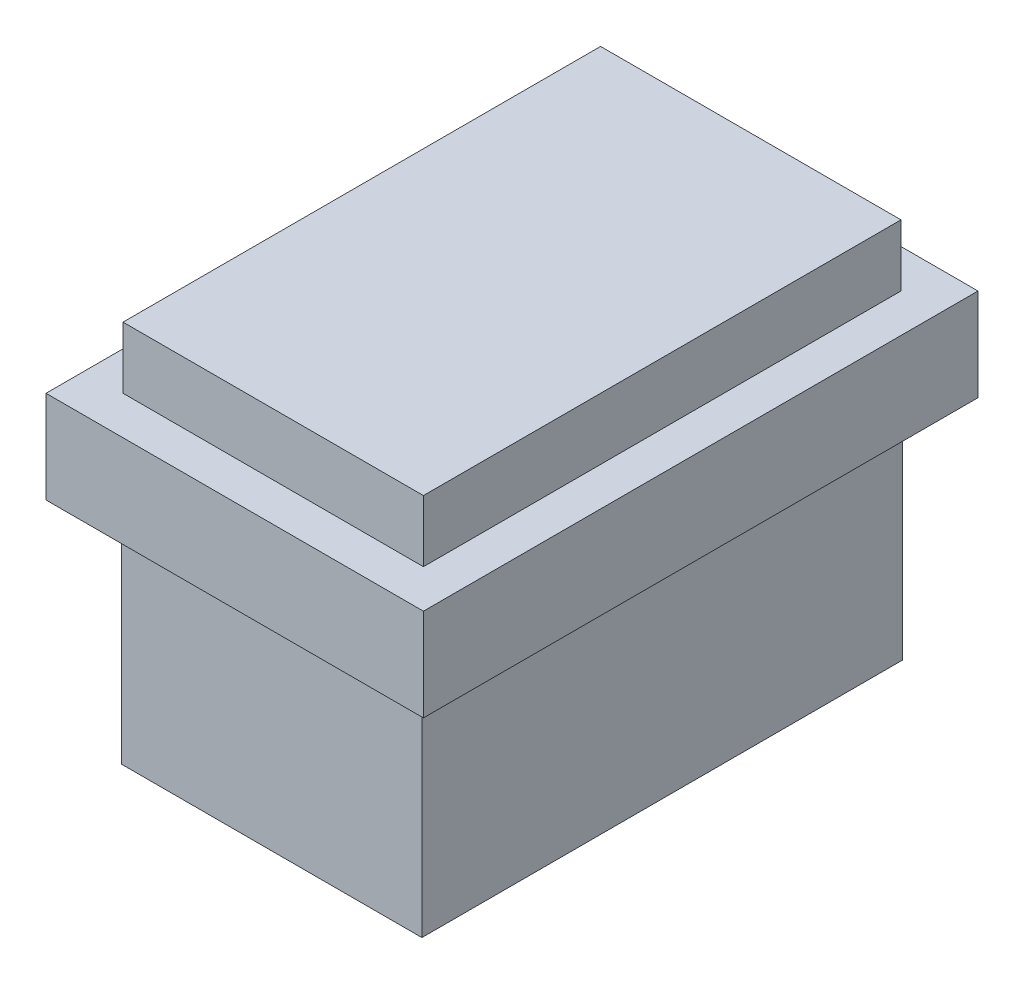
SolidWorks part; units mm, degrees
ref_plane "Front" through (0, 0, 0) normal (0, 0, 1) x (1, 0, 0)
ref_plane "Top" through (0, 0, 0) normal (0, 1, 0) x (1, 0, 0)
ref_plane "Right" through (0, 0, 0) normal (1, 0, 0) x (0, 0, -1)
sketch "Sketch1" plane through (0, 0, 0) normal (1, 0, 0) x (0, 0, -1)
  line L1 (-198.12, 0) -> (198.12, 0)
  line L2 (-198.12, 0) -> (-198.12, 187.96)
  line L3 (-198.12, 187.96) -> (198.12, 187.96)
  line L4 (198.12, 0) -> (198.12, 187.96)
  dimension "D1" = 396.24
  dimension "D2" = 187.96
extrude "Extrude1" add sketch "Sketch1" along normal mid plane 247.65
sketch "Sketch2" plane through (0, 187.96, 0) normal (0, 1, 0) x (-1, 0, 0)
  line L1 (155.575, 228.6) -> (-155.575, 228.6)
  line L2 (155.575, 228.6) -> (155.575, -228.6)
  line L3 (155.575, -228.6) -> (-155.575, -228.6)
  line L4 (-155.575, 228.6) -> (-155.575, -228.6)
  line L6 (0, -228.6) -> (0, 228.6) construction
  line L7 (155.575, 0) -> (-155.575, 0) construction
  line L8 (123.825, -198.12) -> (123.825, 198.12) construction
  line L9 (-123.825, -198.12) -> (123.825, -198.12) construction
  point P10 (123.825, 0)
  point P11 (0, -198.12)
  dimension "D1" = 311.15
  dimension "D3" = 457.2
extrude "Extrude2" add sketch "Sketch2" along normal blind 76.2
sketch "Sketch4" plane through (0, 0, 0) normal (1, 0, 0) x (0, 0, -1)
  line L1 (-196.85, 264.16) -> (196.85, 264.16)
  line L2 (-196.85, 264.16) -> (-196.85, 314.96)
  line L3 (-196.85, 314.96) -> (196.85, 314.96)
  line L4 (196.85, 264.16) -> (196.85, 314.96)
  line L5 (0, 0) -> (0, 407.0133) construction
  dimension "D1" = 50.8
  dimension "D2" = 393.7
extrude "Extrude4" add sketch "Sketch4" along normal mid plane 247.65
